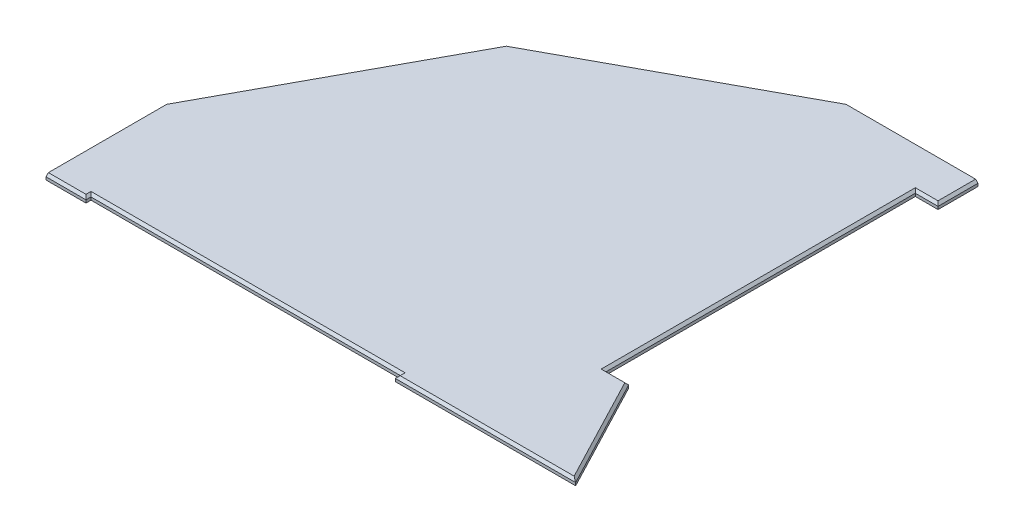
SolidWorks part; units mm, degrees
ref_plane "Front Plane" through (0, 0, 0) normal (1, 0, 0) x (0, 1, 0)
ref_plane "Top Plane" through (0, 0, 0) normal (0, 0, 1) x (0, 1, 0)
ref_plane "Right Plane" through (0, 0, 0) normal (0, 1, 0) x (-1, 0, 0)
sketch "Sketch2" plane through (0, 0, 0) normal (0, 1, 0) x (-1, 0, 0)
  line B0 (604.7159, 547.7126) -> (604.7159, 560.2376)
  line B1 (-418.4966, -491.5527) -> (-475.2966, -491.5527)
  line B2 (604.7159, 547.7126) -> (-169.2841, 547.7126)
  line B3 (-169.2841, 547.7126) -> (-169.2841, 560.2376)
  line B4 (-620.4841, 560.2376) -> (-169.2841, 560.2376)
  line B5 (-620.4841, 560.2376) -> (-475.2966, 282.4473)
  line B6 (-418.4966, 282.4473) -> (-475.2966, 282.4473)
  line B7 (-418.4966, 282.4473) -> (-418.4966, -491.5527)
  line B8 (-475.2966, -491.5527) -> (-475.2966, -591.5527)
  line B9 (-475.2966, -591.5527) -> (-145.1683, -591.5527)
  line B10 (-145.1683, -591.5527) -> (405.7448, -292.5815)
  line B11 (405.7448, -292.5815) -> (704.7159, 258.3315)
  line B12 (704.7159, 560.2376) -> (704.7159, 258.3315)
  line B13 (604.7159, 560.2376) -> (704.7159, 560.2376)
sketch_block_instance "Block3-1"
sketch_block "Block3" parameters "D1"=6, "D2"=6, "D3"=6
extrude "Boss-Extrude2" add sketch "Sketch2" along normal mid plane 19.05
chamfer "Chamfer1" distance 6 angle 45 20 edges at (-654.7159, -9.525, 560.2376) (-604.7159, -9.525, 553.9751) (-217.7159, -9.525, 547.7126) (169.2841, -9.525, 553.9751) (394.8841, -9.525, 560.2376) (475.2966, -9.525, -541.5527) (446.8966, -9.525, -491.5527) (418.4966, -9.525, -104.5527) (446.8966, -9.525, 282.4473) (547.8903, -9.525, 421.3425) (-654.7159, 9.525, 560.2376) (-604.7159, 9.525, 553.9751) (-217.7159, 9.525, 547.7126) (169.2841, 9.525, 553.9751) (394.8841, 9.525, 560.2376) (475.2966, 9.525, -541.5527) (446.8966, 9.525, -491.5527) (418.4966, 9.525, -104.5527) (446.8966, 9.525, 282.4473) (547.8903, 9.525, 421.3425)
